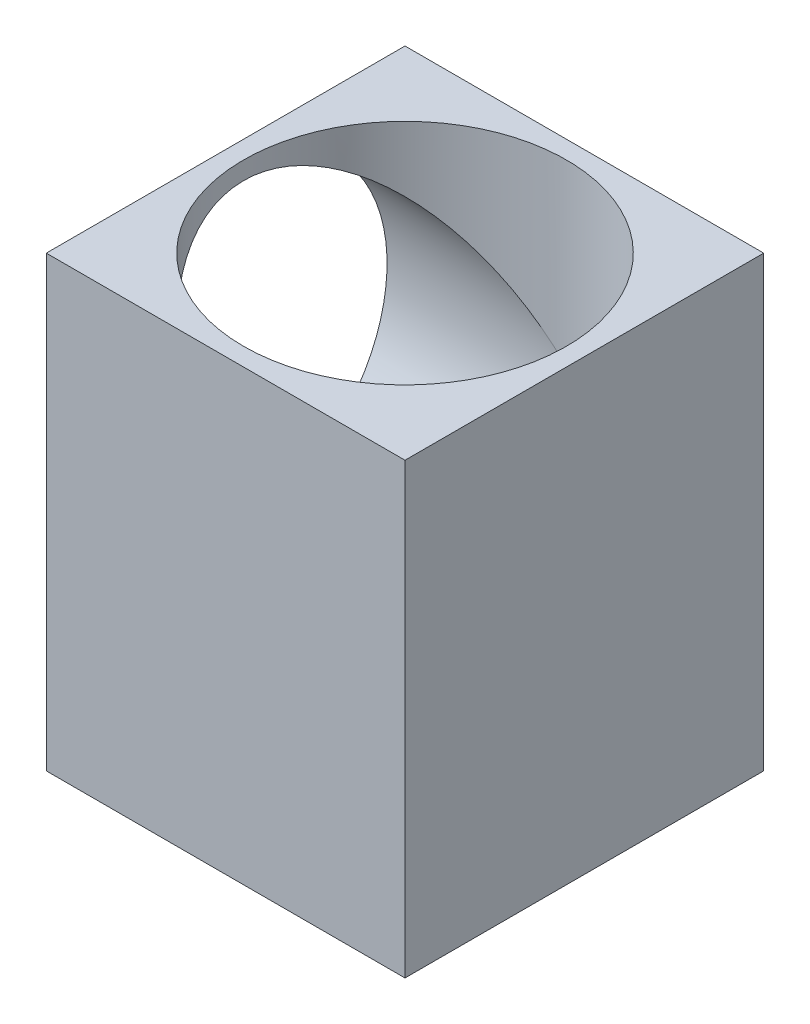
SolidWorks part; units mm, degrees
ref_plane "Front Plane" through (0, 0, 0) normal (0, 0, 1) x (1, 0, 0)
ref_plane "Top Plane" through (0, 0, 0) normal (0, 1, 0) x (1, 0, 0)
ref_plane "Right Plane" through (0, 0, 0) normal (1, 0, 0) x (0, 0, -1)
sketch "Sketch1" plane through (0, 0, 0) normal (0, 1, 0) x (1, 0, 0)
  line L1 (-5, 5) -> (5, 5)
  line L2 (-5, 5) -> (-5, -5)
  line L3 (-5, -5) -> (5, -5)
  line L4 (5, 5) -> (5, -5)
  line L5 (-5, 5) -> (5, -5) construction
  line L6 (-5, -5) -> (5, 5) construction
  point P0 (0, 0)
  dimension "D1" = 10
  dimension "D2" = 10
extrude "Boss-Extrude1" add sketch "Sketch1" along normal blind 12.5
sketch "Sketch2" plane through (0, 12.5, 0) normal (0, 1, 0) x (1, 0, 0)
  circle A0 centre (0, 0) radius 4.5
  dimension "D1" = 9
extrude "Cut-Extrude1" cut sketch "Sketch2" against normal blind 10
sketch "Sketch3" plane through (-5, 0, 0) normal (-1, 0, 0) x (0, 0, 1)
  line L0 (-5, 12.5) -> (5, 12.5) construction
  circle A0 centre (0, 7.5) radius 4.5
  dimension "D2" = 9
  dimension "D1" = 5
extrude "Cut-Extrude2" cut sketch "Sketch3" against normal blind 5
hole_wizard "1/4-20 Tapped Hole1" positions "Sketch6" profile "Sketch7" tap size "1/4-20" standard "ANSI Inch"
sketch "Sketch6" plane through (0, 0, 0) normal (0, -1, 0) x (-1, 0, 0)
  point P0 (0, 0)
sketch "Sketch7" plane through (0, 0, 0) normal (1, 0, 0) x (0, 0, -1)
  line L0 (0, 0) -> (0, 2.5)
  line L1 (0, 2.5) -> (2.5527, 2.5)
  line L2 (2.5527, 2.5) -> (2.5527, 0)
  line L5 (2.5527, 0) -> (0, 0)
  line L11 (0, -6.35) -> (0, 107.95) construction
  dimension "Thru Tap Drill Dia." = 5.1054
  dimension "Thru Tap Drill Depth" = 2.5
